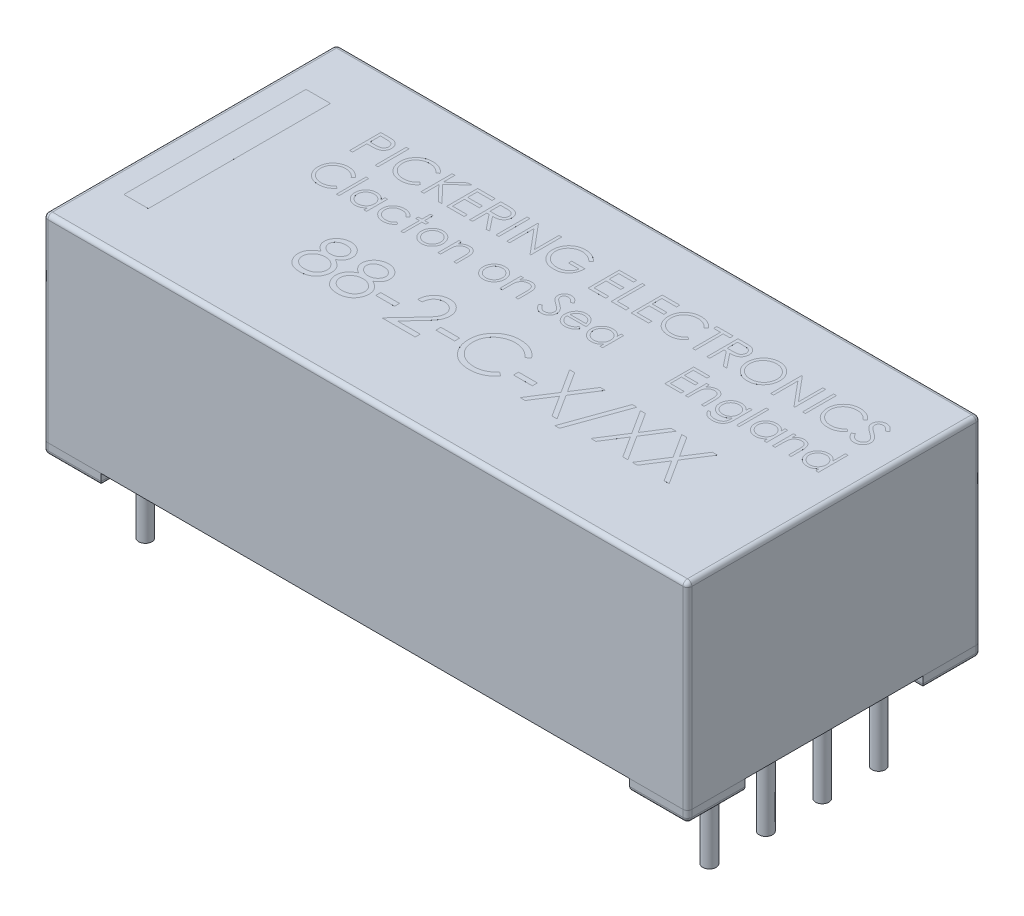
SolidWorks part; units mm, degrees
ref_plane "Front Plane" through (0, 0, 0) normal (0, 0, 1) x (1, 0, 0)
ref_plane "Top Plane" through (0, 0, 0) normal (0, 1, 0) x (1, 0, 0)
ref_plane "Right Plane" through (0, 0, 0) normal (1, 0, 0) x (0, 0, -1)
sketch "Sketch2" plane through (0, 0, 0) normal (0, 1, 0) x (1, 0, 0)
  line L1 (14.5, -6.6) -> (-14.5, -6.6)
  line L2 (14.5, -6.6) -> (14.5, 6.6)
  line L3 (14.5, 6.6) -> (-14.5, 6.6)
  line L4 (-14.5, -6.6) -> (-14.5, 6.6)
  line L5 (14.5, -6.6) -> (-14.5, 6.6) construction
  line L6 (14.5, 6.6) -> (-14.5, -6.6) construction
  point P0 (0, 0)
  dimension "D1" = 13.2
  dimension "D2" = 29
extrude "Main Body" add sketch "Sketch2" along normal blind 8.89 draft 0.023
sketch "Sketch9" plane through (0, 0, 0) normal (0, -1, 0) x (1, 0, 0)
  line L0 (14.5, -6.6) -> (-14.5, -6.6) construction
  line L1 (14.5, 6.6) -> (14.5, -6.6) construction
  circle A0 centre (12.7, -3.81) radius 0.3
  circle A1 centre (12.7, -1.27) radius 0.2963
  circle A2 centre (12.7, 1.27) radius 0.3
  circle A3 centre (12.7, 3.8104) radius 0.2999
  dimension "D1" = 0.6
  dimension "D5" = 0.6
  dimension "D7" = 0.6
  dimension "D2" = 2.79
  dimension "D3" = 2.54
  dimension "D4" = 1.8
  dimension "D6" = 2.54
  dimension "D8" = 2.54
extrude "Pins" add sketch "Sketch9" along normal blind 4.31
mirror "Mirror2" about plane through (0, 0, 0) normal (1, 0, 0) of "Pins"
sketch "Sketch10" plane through (0, 0, 0) normal (0, -1, 0) x (1, 0, 0)
  line L1 (14.5, 6.6) -> (11.9, 6.6)
  line L2 (14.5, 6.6) -> (14.5, 4)
  line L3 (14.5, 4) -> (11.9, 4)
  line L4 (11.9, 6.6) -> (11.9, 4)
  dimension "D1" = 2.6
  dimension "D2" = 2.6
extrude "Foot" add sketch "Sketch10" along normal blind 0.51
sketch "Sketch11" plane through (0, -0.51, 0) normal (0, -1, 0) x (1, 0, 0)
  line L0 (14.5, 6.6) -> (11.9, 6.6) construction
  line L1 (11.9, 4) -> (13.95, 4)
  line L2 (11.9, 4) -> (11.9, 6.05)
  line L3 (11.9, 6.05) -> (13.95, 6.05)
  line L4 (13.95, 4) -> (13.95, 6.05)
  line L5 (14.5, 4) -> (14.5, 6.6) construction
  dimension "D1" = 0.55
  dimension "D2" = 0.55
extrude "Extrude2" cut sketch "Sketch11" against normal up to surface (0.51 mm away)
mirror "Mirror3" about plane through (0, 0, 0) normal (0, 0, 1) of "Extrude2", "Foot"
mirror "Mirror4" about plane through (0, 0, 0) normal (1, 0, 0) of "Mirror3", "Foot", "Extrude2"
sketch "Sketch12"
  dimension "D1" = 1.1
  dimension "D2" = 8.2
  dimension "D3" = 2.4965
  dimension "D4" = 1.4
  dimension "D5" = 2
  dimension "D6" = 3.8
extrude "Lettering" add sketch "Sketch12" along normal blind 0.0001
fillet "Fillet1" radius 0.2 36 edges at (-14.5, -0.255, -6.6) (14.5, -0.255, -6.6) (14.5, -0.255, 6.6) (-14.5, -0.255, 6.6) (-14.225, -0.51, 4) (-14.5, -0.51, 5.3) (-13.2, -0.51, 6.6) (-11.9, -0.51, 6.325) (-12.925, -0.51, 6.05) (-13.95, -0.51, 5.025) (-11.9, -0.51, -6.325) (-13.2, -0.51, -6.6) (-14.5, -0.51, -5.3) (-14.225, -0.51, -4) (-13.95, -0.51, -5.025) (-12.925, -0.51, -6.05) (11.9, -0.51, 6.325) (13.2, -0.51, 6.6) (14.5, -0.51, 5.3) (14.225, -0.51, 4) (13.95, -0.51, 5.025) (12.925, -0.51, 6.05) (14.225, -0.51, -4) (14.5, -0.51, -5.3) (13.2, -0.51, -6.6) (11.9, -0.51, -6.325) (12.925, -0.51, -6.05) (13.95, -0.51, -5.025) (14.4965, 8.89, 0) (0, 8.89, -6.5965) (-14.4983, 4.445, -6.5983) (14.4983, 4.445, -6.5983) (14.4983, 4.445, 6.5983) (0, 8.89, 6.5965) (-14.4965, 8.89, 0) (-14.4983, 4.445, 6.5983)
